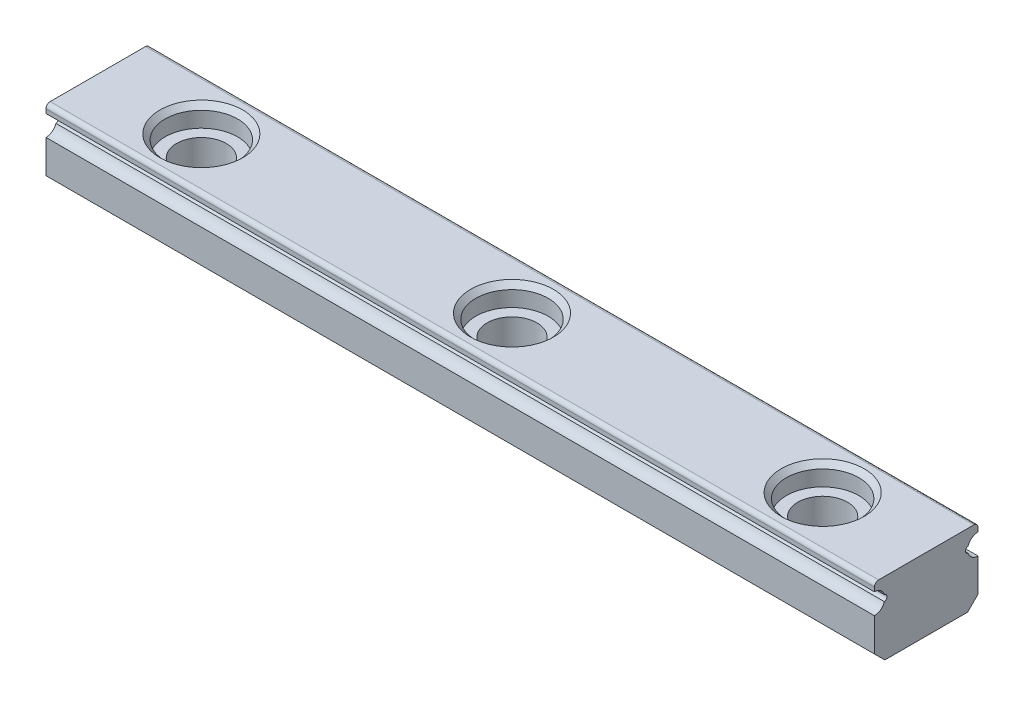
SolidWorks part; units mm, degrees
ref_plane "前基準面" through (0, 0, 0) normal (0, 0, 1) x (1, 0, 0)
ref_plane "上基準面" through (0, 0, 0) normal (0, 1, 0) x (1, 0, 0)
ref_plane "右基準面" through (0, 0, 0) normal (1, 0, 0) x (0, 0, -1)
sketch "草圖1" plane through (0, 0, 0) normal (1, 0, 0) x (0, 0, -1)
  line L0 (-2, 0) -> (-2.5, 0.5)
  line L1 (2, 0) -> (-2, 0)
  line L2 (2.5, 0.5) -> (2.5, 3.5)
  line L3 (2.5, 3.5) -> (-2.5, 3.5)
  line L4 (-2.5, 0.5) -> (-2.5, 3.5)
  line L5 (0, 3.5) -> (0, 2.0812) construction
  line L6 (2, 0) -> (2.5, 0.5)
  dimension "D1" = 5
  dimension "D2" = 3.5
  dimension "D3" = 45
  dimension "D4" = 0.5
extrude "Extrude1" add sketch "草圖1" against normal blind 40
hole_wizard "HoleWzd1" positions "草圖3" profile "草圖2" counterbore size "M2.5" standard "ISO"
sketch "草圖3" plane through (0, 3.5, 0) normal (0, 1, 0) x (-1, 0, 0)
  line L1 (0, -2.5) -> (0, 2.5) construction
  line L2 (40, -2.5) -> (0, -2.5) construction
  point P0 (5, 0)
  dimension "D1" = 2.5
  dimension "D2" = 5
sketch "草圖2" plane through (-5, 3.5, 0) normal (1, 0, 0) x (0, 0, 1)
  line L0 (0, 0) -> (0, 3.5)
  line L1 (1.2, 3.3) -> (1.4, 3.5)
  line L2 (1.75, 1) -> (1.2, 1)
  line L3 (1.2, 1) -> (1.2, 3.3)
  line L5 (1.75, 1) -> (1.75, 0.25)
  line L6 (1.75, 0.25) -> (2, 0)
  line L7 (2, 0) -> (0, 0)
  line L8 (-1.75, 0.25) -> (-2, 0) construction
  line L11 (0, -6.35) -> (0, 107.95) construction
  line L12 (1.4, 3.5) -> (0, 3.5)
  line L13 (-1.2, 3.3) -> (-1.4, 3.5) construction
  dimension "貫穿孔直徑" = 2.4
  dimension "貫穿孔深度" = 3.5
  dimension "柱孔直徑" = 3.5
  dimension "柱孔深度" = 1
  dimension "近端錐孔直徑" = 4
  dimension "近端錐孔角度" = 90
  dimension "遠端錐孔直徑" = 2.8
  dimension "遠端錐孔角度" = 90
pattern_linear "LPattern1" count 3 spacing 15 along (-1, 0, 0) of "HoleWzd1"
sketch "Sketch1" plane through (0, 0, 0) normal (1, 0, 0) x (0, 0, -1)
  line L0 (2.0453, 2.6) -> (2.6464, 2.6) construction
  line L2 (-2, 0) -> (2, 0) construction
  line L3 (2.5, 0.5) -> (2.5, 3.5) construction
  line L4 (-2.7032, 0) -> (2.7759, 0) construction
  line L5 (0, 3.1997) -> (0, 0) construction
  line L7 (-2.5, 3.5) -> (-2.5, 0.5) construction
  arc A0 (2.0225, 2.7483) -> (2.0225, 2.4517) centre (2.0453, 2.6) ccw
  arc A1 (2.0225, 2.4517) -> (2.0225, 2.7483) centre (2.5, 2.6) ccw
  arc A2 (-2.0225, 2.7483) -> (-2.0225, 2.4517) centre (-2.0453, 2.6) cw
  arc A3 (-2.0225, 2.4517) -> (-2.0225, 2.7483) centre (-2.5, 2.6) cw
  dimension "D1" = 0.3
  dimension "D2" = 1
  dimension "D3" = 0.4547
  dimension "D4" = 2.6
extrude "Cut-Extrude1" cut sketch "Sketch1" against normal through all
fillet "Fillet1" radius 0.2 2 edges at (-20, 3.5, -2.5) (-20, 3.5, 2.5)
